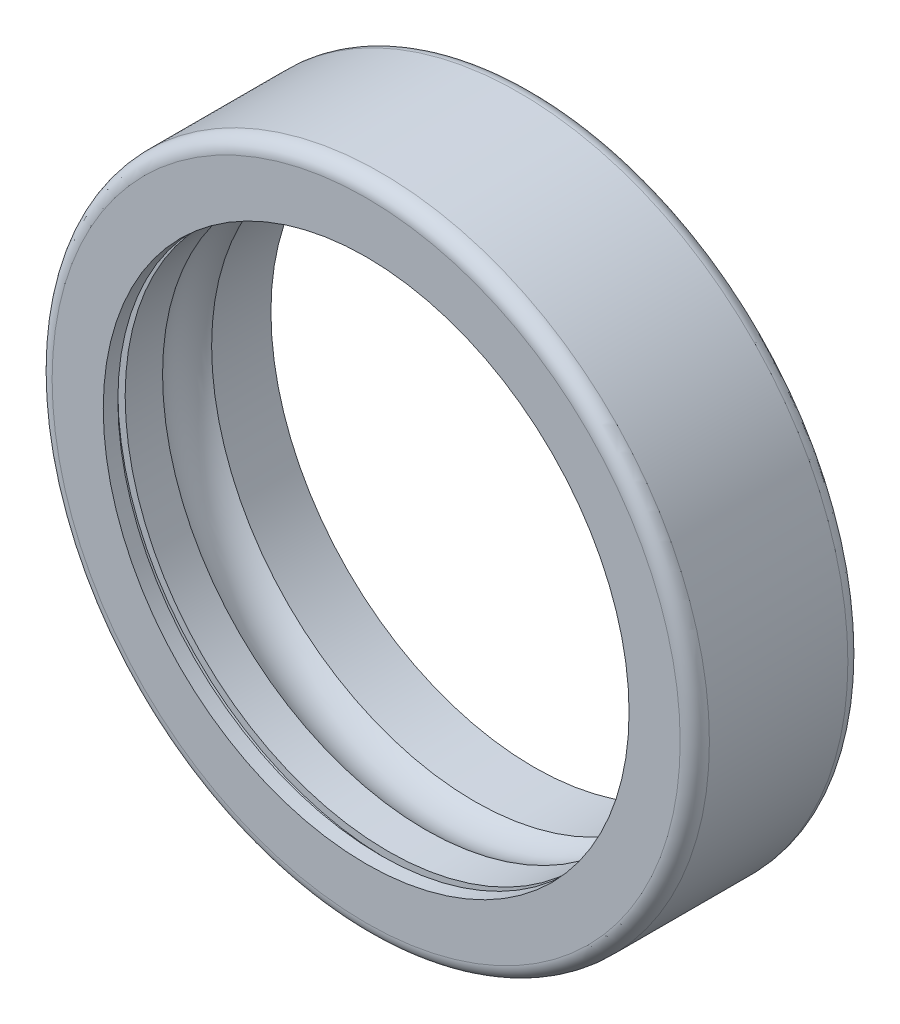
SolidWorks part; units mm, degrees
ref_plane "Plan1" through (0, 0, 0) normal (0, 0, 1) x (1, 0, 0)
ref_plane "Plan2" through (0, 0, 0) normal (0, 1, 0) x (1, 0, 0)
ref_plane "Plan3" through (0, 0, 0) normal (1, 0, 0) x (0, 0, -1)
sketch "Esquisse1" plane through (0, 0, 0) normal (1, 0, 0) x (0, 0, -1)
  line L0 (-2.37, 11.25) -> (2.37, 11.25)
  line L1 (-2.87, 10.75) -> (-2.87, 9)
  line L2 (2.87, 9) -> (0.84, 9)
  line L3 (2.87, 9) -> (2.87, 10.75)
  line L4 (-0.84, 9) -> (-2.12, 9)
  line L5 (0, 0) -> (-9, 0) construction
  line L6 (-2.37, 9) -> (-2.37, 9.25)
  line L7 (-2.37, 9.25) -> (-2.12, 9.25)
  line L8 (0, 6) -> (0, -2) construction
  line L9 (-2.12, 9.25) -> (-2.12, 9)
  line L10 (-2.37, 9) -> (-2.87, 9)
  arc A0 (0.84, 9) -> (-0.84, 9) centre (0, 7.88) ccw
  arc A1 (2.87, 10.75) -> (2.37, 11.25) centre (2.37, 10.75) ccw
  arc A2 (-2.87, 10.75) -> (-2.37, 11.25) centre (-2.37, 10.75) cw
  point P14 (2.87, 11.25)
  point P17 (-2.87, 11.25)
  dimension "D5" = 1.4
  dimension "D7" = 0.5
  dimension "D4" = 1.12
  dimension "D1" = 11.25
  dimension "D2" = 2.25
  dimension "D3" = 5.74
  dimension "D6" = 2.87
  dimension "D8" = 0.5
  dimension "D9" = 0.25
  dimension "D10" = 0.25
revolve "Base-Révolution" add sketch "Esquisse1" angle 360 about L5
